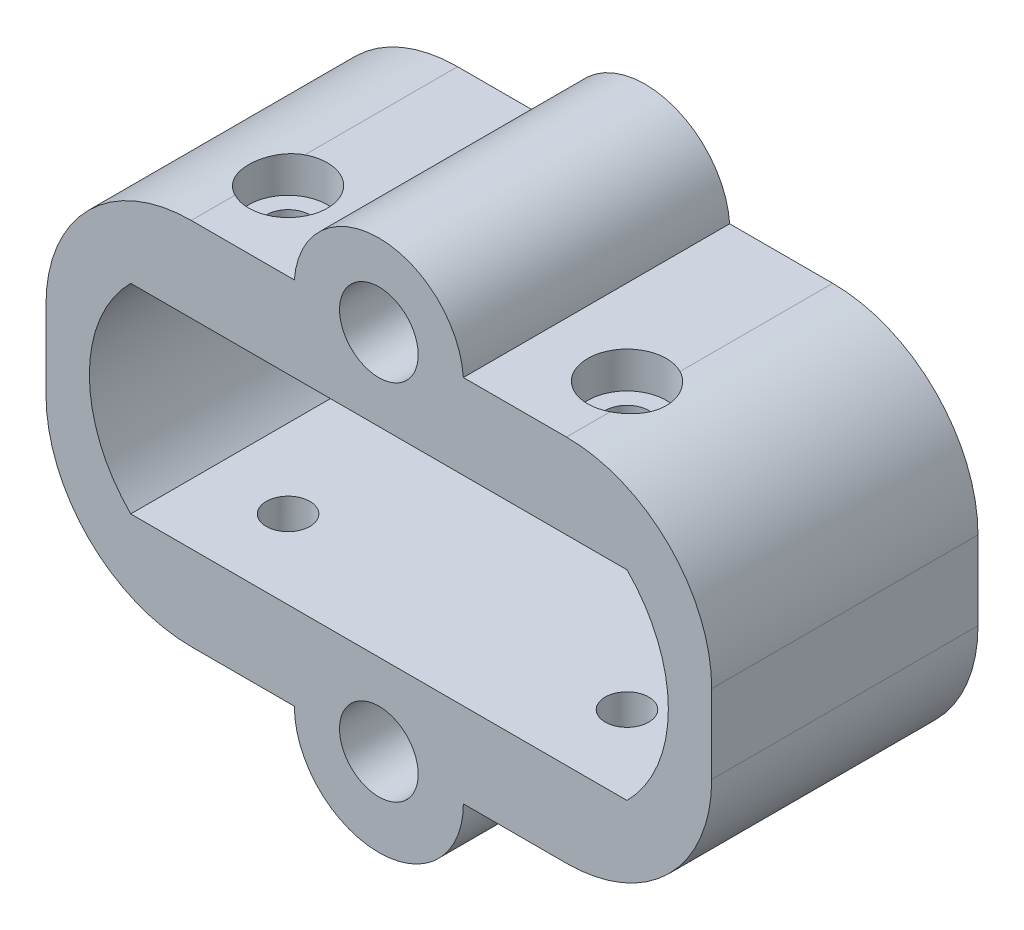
SolidWorks part; units mm, degrees
ref_plane "Front Plane" through (0, 0, 0) normal (0, 0, 1) x (1, 0, 0)
ref_plane "Top Plane" through (0, 0, 0) normal (0, 1, 0) x (1, 0, 0)
ref_plane "Right Plane" through (0, 0, 0) normal (1, 0, 0) x (0, 0, -1)
sketch "Sketch1" plane through (0, 0, 0) normal (0, 0, 1) x (1, 0, 0)
  line L0 (-15.5, 15.25) -> (-6.9821, 15.25)
  line L1 (-20.5, -8.25) -> (20.5, -8.25)
  line L3 (-20.5, 8.25) -> (20.5, 8.25)
  line L5 (-20.5, -8.25) -> (20.5, 8.25) construction
  line L6 (-20.5, 8.25) -> (20.5, -8.25) construction
  line L7 (27.5, -3.25) -> (27.5, 3.25)
  line L8 (-15.5, -15.25) -> (-6.9821, -15.25)
  line L9 (-27.5, -3.25) -> (-27.5, 3.25)
  line L10 (0, -15.25) -> (0, 14.75) construction
  line L11 (6.9821, -15.25) -> (15.5, -15.25)
  line L12 (-27.5, -15.25) -> (27.5, -15.25) construction
  line L13 (6.9821, 15.25) -> (15.5, 15.25)
  line L14 (-27.5, 15.25) -> (27.5, 15.25) construction
  line L15 (27.5, -15.25) -> (27.5, 15.25) construction
  line L16 (-27.5, -15.25) -> (-27.5, 15.25) construction
  line L17 (-20.5, -8.25) -> (-20.5, 8.25) construction
  line L18 (20.5, -8.25) -> (20.5, 8.25) construction
  arc A0 (-6.9821, -15.25) -> (6.9821, -15.25) centre (0, -15.25) ccw
  arc A1 (6.9821, 15.25) -> (-6.9821, 15.25) centre (0, 14.75) ccw
  arc A2 (15.5, 15.25) -> (27.5, 3.25) centre (15.5, 3.25) cw
  arc A3 (27.5, -3.25) -> (15.5, -15.25) centre (15.5, -3.25) cw
  arc A4 (-15.5, -15.25) -> (-27.5, -3.25) centre (-15.5, -3.25) cw
  arc A5 (-15.5, 15.25) -> (-27.5, 3.25) centre (-15.5, 3.25) ccw
  arc A6 (-20.5, 8.25) -> (-20.5, -8.25) centre (-12.25, 0) ccw
  arc A7 (20.5, 8.25) -> (20.5, -8.25) centre (12.25, 0) cw
  point P0 (0, 0)
  point P12 (0, 0)
  dimension "D4" = 7
  dimension "D6" = 12
  dimension "D1" = 41
  dimension "D2" = 16.5
  dimension "D5" = 30
  dimension "D3" = 7
extrude "Boss-Extrude1" add sketch "Sketch1" along normal blind 22
hole_wizard "CBORE for M3 SHCS1" positions "Sketch3" profile "Sketch2" counterbore size "M3" standard "ANSI Metric"
sketch "Sketch3" plane through (0, 0, 22) normal (0, 0, 1) x (1, 0, 0)
  line L0 (0, 8.25) -> (0, -8.25) construction
  line L1 (20.5, 8.25) -> (-20.5, 8.25) construction
  line L2 (-20.5, -8.25) -> (20.5, -8.25) construction
  point P0 (0, 15)
  point P2 (0, -15)
  dimension "D1" = 15
  dimension "D2" = 15
sketch "Sketch2" plane through (0, 15, 22) normal (1, 0, 0) x (0, -1, 0)
  line L0 (0, 0) -> (0, 22)
  line L1 (0, 22) -> (1.8, 22)
  line L3 (1.8, 22) -> (1.8, 20.5)
  line L4 (1.8, 20.5) -> (3.25, 20.5)
  line L5 (3.25, 20.5) -> (3.25, 0)
  line L7 (3.25, 0) -> (0, 0)
  line L11 (0, -6.35) -> (0, 107.95) construction
  dimension "Thru Hole Dia." = 3.6
  dimension "Thru Hole Depth" = 22
  dimension "C'Bore Dia." = 6.5
  dimension "C'Bore Depth" = 20.5
hole_wizard "CBORE for M3 SHCS2" positions "Sketch5" profile "Sketch4" counterbore size "M3" standard "ANSI Metric"
sketch "Sketch5" plane through (0, 15.25, 0) normal (0, 1, 0) x (1, 0, 0)
  line L0 (-6.9821, 0) -> (-15.5, 0) construction
  line L1 (15.5, 0) -> (6.9821, 0) construction
  point P0 (14, -15.5)
  point P2 (-14, -15.5)
  dimension "D1" = 15.5
  dimension "D2" = 15.5
  dimension "D3" = 14
  dimension "D4" = 14
sketch "Sketch4" plane through (14, 15.25, 15.5) normal (1, 0, 0) x (0, 0, 1)
  line L0 (0, 0) -> (0, 37.4821)
  line L1 (0, 37.4821) -> (1.8, 37.4821)
  line L3 (1.8, 37.4821) -> (1.8, 3)
  line L4 (1.8, 3) -> (3.25, 3)
  line L5 (3.25, 3) -> (3.25, 0)
  line L7 (3.25, 0) -> (0, 0)
  line L11 (0, -6.35) -> (0, 107.95) construction
  dimension "Thru Hole Dia." = 3.6
  dimension "Thru Hole Depth" = 37.4821
  dimension "C'Bore Dia." = 6.5
  dimension "C'Bore Depth" = 3
